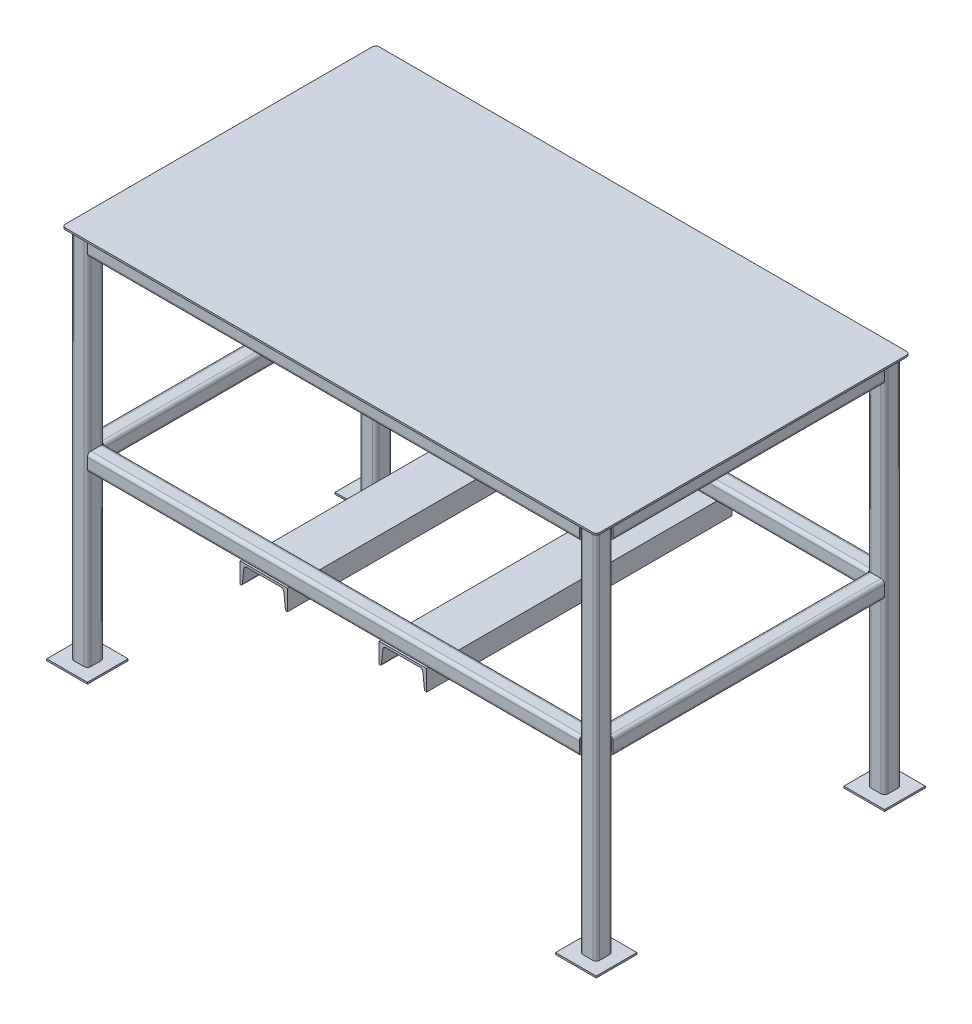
SolidWorks part; units mm, degrees
ref_plane "Default Plane" through (787.5, 1105, 452.5) normal (0, -1, 0) x (-1, 0, 0)
sketch3d "Bounding-Box_Cut-List-Item4"
  line L0 (0, 915, 0) -> (1575, 915, 0) construction
  line L1 (1575, 915, 0) -> (1575, -10, 0) construction
  line L2 (1575, -10, 0) -> (0, -10, 0) construction
  line L3 (0, -10, 0) -> (0, 915, 0) construction
  line L4 (0, 915, 5) -> (1575, 915, 5) construction
  line L5 (1575, 915, 5) -> (1575, -10, 5) construction
  line L6 (1575, -10, 5) -> (0, -10, 5) construction
  line L7 (0, -10, 5) -> (0, 915, 5) construction
  line L8 (0, 915, 0) -> (0, 915, 5) construction
  line L9 (1575, 915, 0) -> (1575, 915, 5) construction
  line L10 (1575, -10, 0) -> (1575, -10, 5) construction
  line L11 (0, -10, 0) -> (0, -10, 5) construction
ref_plane "Default Plane" through (810, 0, -365) normal (0, -1, 0) x (-1, 0, 0)
sketch3d "Bounding-Box_Cut-List-Item5"
  line L0 (120, 0, 0) -> (120, 120, 0) construction
  line L1 (120, 120, 0) -> (0, 120, 0) construction
  line L2 (0, 120, 0) -> (0, 0, 0) construction
  line L3 (0, 0, 0) -> (120, 0, 0) construction
  line L4 (120, 0, 5) -> (120, 120, 5) construction
  line L5 (120, 120, 5) -> (0, 120, 5) construction
  line L6 (0, 120, 5) -> (0, 0, 5) construction
  line L7 (0, 0, 5) -> (120, 0, 5) construction
  line L8 (120, 0, 0) -> (120, 0, 5) construction
  line L9 (120, 120, 0) -> (120, 120, 5) construction
  line L10 (0, 120, 0) -> (0, 120, 5) construction
  line L11 (0, 0, 0) -> (0, 0, 5) construction
ref_plane "Front Plane" through (0, 0, 0) normal (0, 0, 1) x (1, 0, 0)
ref_plane "Top Plane" through (0, 0, 0) normal (0, 1, 0) x (1, 0, 0)
ref_plane "Right Plane" through (0, 0, 0) normal (1, 0, 0) x (0, 0, -1)
sketch3d "Frame Layout"
  line L0 (-750, 0, 425) -> (-750, 1100, 425)
  line L1 (-750, 0, 425) -> (-750, 0, -425) construction
  line L2 (-750, 0, 425) -> (750, 0, 425) construction
  line L3 (750, 0, 425) -> (750, 0, -425) construction
  line L4 (-750, 0, -425) -> (750, 0, -425) construction
  line L5 (-750, 0, 425) -> (750, 0, -425) construction
  line L6 (750, 0, 425) -> (-750, 0, -425) construction
  line L7 (-750, 0, -425) -> (-750, 1100, -425)
  line L8 (750, 0, 425) -> (750, 1100, 425)
  line L9 (750, 0, -425) -> (750, 1100, -425)
  line L10 (0, 1100, -425) -> (0, 1100, 425)
  line L11 (-750, 1100, 425) -> (-750, 1100, -425)
  line L12 (-750, 1100, 425) -> (750, 1100, 425)
  line L13 (750, 1100, 425) -> (750, 1100, -425)
  line L14 (-750, 1100, -425) -> (750, 1100, -425)
  line L15 (-750, 550, 425) -> (-750, 550, -425)
  line L16 (-750, 550, -425) -> (750, 550, -425)
  line L17 (750, 550, -425) -> (750, 550, 425)
  line L18 (750, 550, 425) -> (-750, 550, 425)
  point P0 (0, 0, 0)
  dimension "D1" = 1500
  dimension "D2" = 850
  dimension "D3" = 1100
other "Tube (square) 50 X 50 X 5.0(1)"
ref_plane "Plane1" through (-750, 0, 425) normal (0, 1, 0) x (1, 0, 0)
sketch "Sketch1" plane through (-750, 0, 425) normal (0, 1, 0) x (1, 0, 0)
  line L0 (-15, -20) -> (15, -20)
  line L1 (-20, -15) -> (-20, 15)
  line L2 (15, 20) -> (-15, 20)
  line L3 (20, 15) -> (20, -15)
  line L4 (-15, -25) -> (15, -25)
  line L5 (-25, -15) -> (-25, 15)
  line L6 (15, 25) -> (-15, 25)
  line L7 (25, 15) -> (25, -15)
  line L8 (-25, 0) -> (-20, 0) construction
  line L9 (-20, 0) -> (20, 0) construction
  line L10 (20, 0) -> (25, 0) construction
  line L12 (0, 25) -> (0, 20) construction
  line L13 (0, 20) -> (0, -20) construction
  line L14 (0, -20) -> (0, -25) construction
  arc A0 (25, 15) -> (15, 25) centre (15, 15) ccw
  arc A1 (15, -25) -> (25, -15) centre (15, -15) ccw
  arc A2 (-25, -15) -> (-15, -25) centre (-15, -15) ccw
  arc A3 (-15, 25) -> (-25, 15) centre (-15, 15) ccw
  arc A4 (-15, 20) -> (-20, 15) centre (-15, 15) ccw
  arc A5 (20, 15) -> (15, 20) centre (15, 15) ccw
  arc A6 (15, -20) -> (20, -15) centre (15, -15) ccw
  arc A7 (-20, -15) -> (-15, -20) centre (-15, -15) ccw
  point P2 (-25, 25)
  point P33 (-25, -25)
  point P34 (25, -25)
  point P36 (25, 25)
  point P37 (0, 0)
  dimension "D1" = 10
  dimension "Thickness" = 5
  dimension "V_leg" = 50
  dimension "H_leg" = 50
sketch "Sketch2" plane through (0, 1100, 0) normal (0, 1, 0) x (1, 0, 0)
  line L1 (787.5, 462.5) -> (-787.5, 462.5)
  line L2 (787.5, 462.5) -> (787.5, -462.5)
  line L3 (787.5, -462.5) -> (-787.5, -462.5)
  line L4 (-787.5, 462.5) -> (-787.5, -462.5)
  line L5 (787.5, 462.5) -> (-787.5, -462.5) construction
  line L6 (787.5, -462.5) -> (-787.5, 462.5) construction
  point P0 (0, 0)
  dimension "D1" = 1575
  dimension "D2" = 925
extrude "Top Plate" add sketch "Sketch2" along normal blind 5 separate body
sketch "Sketch3" plane through (0, 0, 0) normal (0, -1, 0) x (1, 0, 0)
  line L0 (-765, 450) -> (-735, 450) construction
  line L1 (-810, 485) -> (-690, 485)
  line L2 (-810, 485) -> (-810, 365)
  line L3 (-810, 365) -> (-690, 365)
  line L4 (-690, 485) -> (-690, 365)
  line L5 (-750, 365) -> (-750, 485) construction
  line L6 (-810, 425) -> (-690, 425) construction
  line L7 (-725, 440) -> (-725, 410) construction
  point P0 (-750, 425)
  point P6 (-750, 450)
  point P9 (-725, 425)
  dimension "D1" = 120
extrude "Base Plate" add sketch "Sketch3" along normal blind 5 separate body
mirror "Mirror1" about plane through (0, 0, 0) normal (0, 0, 1)
mirror "Mirror2" about plane through (0, 0, 0) normal (1, 0, 0)
fillet "Fillet1" radius 10 4 edges at (-787.5, 1102.5, -462.5) (787.5, 1102.5, -462.5) (787.5, 1102.5, 462.5) (-787.5, 1102.5, 462.5)
sketch "Channel Layout" plane through (0, 500, 0) normal (0, -1, 0) x (1, 0, 0)
  line L0 (0, -450) -> (0, 450) construction
  line L1 (725, 450) -> (-725, 450) construction
  line L2 (-205, 450) -> (-205, -450)
  line L3 (725, -450) -> (-725, -450) construction
  line L4 (205, 450) -> (205, -450)
  point P4 (0, 0)
  dimension "D1" = 410
other "C channel CH 140 X 15(1)"
ref_plane "Plane2" through (-135, 500, 450) normal (0, 0, -1) x (0, -1, 0)
sketch "Sketch11" plane through (-135, 500, 450) normal (0, 0, -1) x (0, -1, 0)
  line L0 (60, 140) -> (0, 140)
  line L1 (60, 0) -> (0, 0)
  line L2 (0, 140) -> (0, 0)
  line L5 (0, 9) -> (30.8145, 9) construction
  line L6 (60, 140) -> (60, 137.8528)
  line L7 (60, 0) -> (60, 2.1472)
  line L12 (6.7, 120.0953) -> (6.7, 19.9047)
  line L17 (14.7592, 129.046) -> (55.9704, 133.3775)
  line L18 (14.7592, 10.954) -> (55.9704, 6.6225)
  arc A0 (55.9704, 133.3775) -> (60, 137.8528) centre (55.5, 137.8528) ccw
  arc A1 (55.9704, 6.6225) -> (60, 2.1472) centre (55.5, 2.1472) cw
  arc A9 (6.7, 19.9047) -> (14.7592, 10.954) centre (15.7, 19.9047) ccw
  arc A10 (6.7, 120.0953) -> (14.7592, 129.046) centre (15.7, 120.0953) cw
  point P10 (30, 140)
  point P11 (30, 0)
  point P12 (6.7, 70)
  point P13 (0, 70)
  point P14 (0, 0)
  dimension "RI" = 9
  dimension "D2" = 6
  dimension "RA" = 4.5
  dimension "D3" = 19.9047
  dimension "Depth" = 140
  dimension "BF" = 60
  dimension "TW" = 6.7
  dimension "TF" = 9
  dimension "d1" = 100.1907
